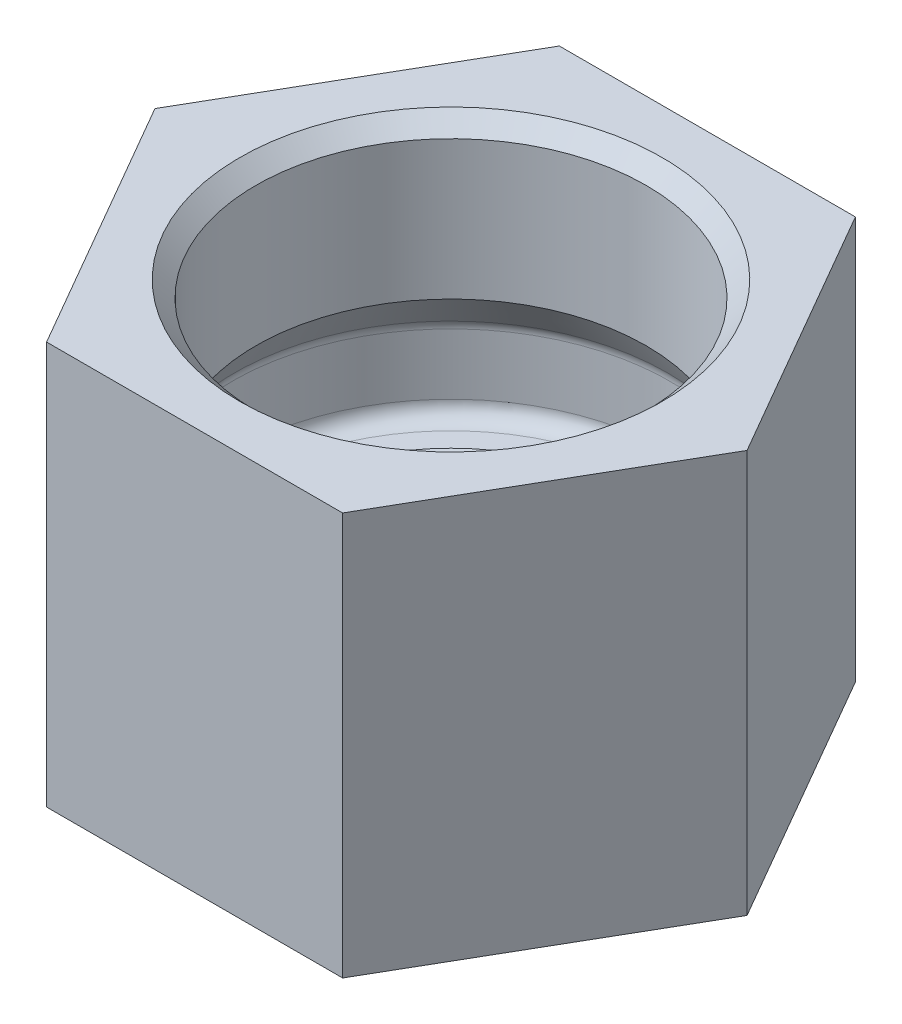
SolidWorks part; units mm, degrees
ref_plane "Přední rovina" through (0, 0, 0) normal (0, 0, 1) x (1, 0, 0)
ref_plane "Horní rovina" through (0, 0, 0) normal (0, 1, 0) x (1, 0, 0)
ref_plane "Pravá rovina" through (0, 0, 0) normal (1, 0, 0) x (0, 0, -1)
sketch "Skica1" plane through (0, 0, 0) normal (1, 0, 0) x (0, 0, -1)
  line L0 (-7, 0) -> (0, 0)
  line L1 (-9.936, 18.8975) -> (0, 18.8975)
  line L2 (0, 0) -> (0, 18.8975)
  line L3 (0, 50.1952) -> (0, 0) construction
  line L4 (-7, 0) -> (-7, 4.5)
  line L5 (-7, 4.5) -> (-8.5, 6)
  line L6 (-8.5, 6) -> (-9.5, 6)
  line L7 (-10.25, 6.75) -> (-10.25, 9.6)
  line L8 (-10.136, 9.9975) -> (-9.136, 11.5975)
  line L9 (-9.136, 11.5975) -> (-9.136, 18.0975)
  line L10 (-9.136, 18.0975) -> (-9.936, 18.8975)
  arc A0 (-9.5, 6) -> (-10.25, 6.75) centre (-9.5, 6.75) cw
  arc A1 (-10.25, 9.6) -> (-10.136, 9.9975) centre (-9.5, 9.6) cw
  dimension "D6" = 0.75
  dimension "D8" = 0.75
  dimension "D1" = 7
  dimension "D2" = 4.5
  dimension "D3" = 1.5
  dimension "D4" = 1.5
  dimension "D5" = 1
  dimension "D7" = 2.85
  dimension "D9" = 1
  dimension "D10" = 1.6
  dimension "D11" = 0.8
  dimension "D12" = 0.8
sketch "Skica4" plane through (0, 0, 0) normal (0, 1, 0) x (1, 0, 0)
  line L1 (13.8564, 0) -> (6.9282, 12)
  line L2 (6.9282, 12) -> (-6.9282, 12)
  line L3 (-6.9282, 12) -> (-13.8564, 0)
  line L4 (-13.8564, 0) -> (-6.9282, -12)
  line L5 (-6.9282, -12) -> (6.9282, -12)
  line L6 (6.9282, -12) -> (13.8564, 0)
  circle A0 centre (0, 0) radius 12 construction
extrude "Přidat vysunutím3" add sketch "Skica4" along normal blind 18.85
revolve "Odebrat rotací1" cut sketch "Skica1" angle 360 about L3
